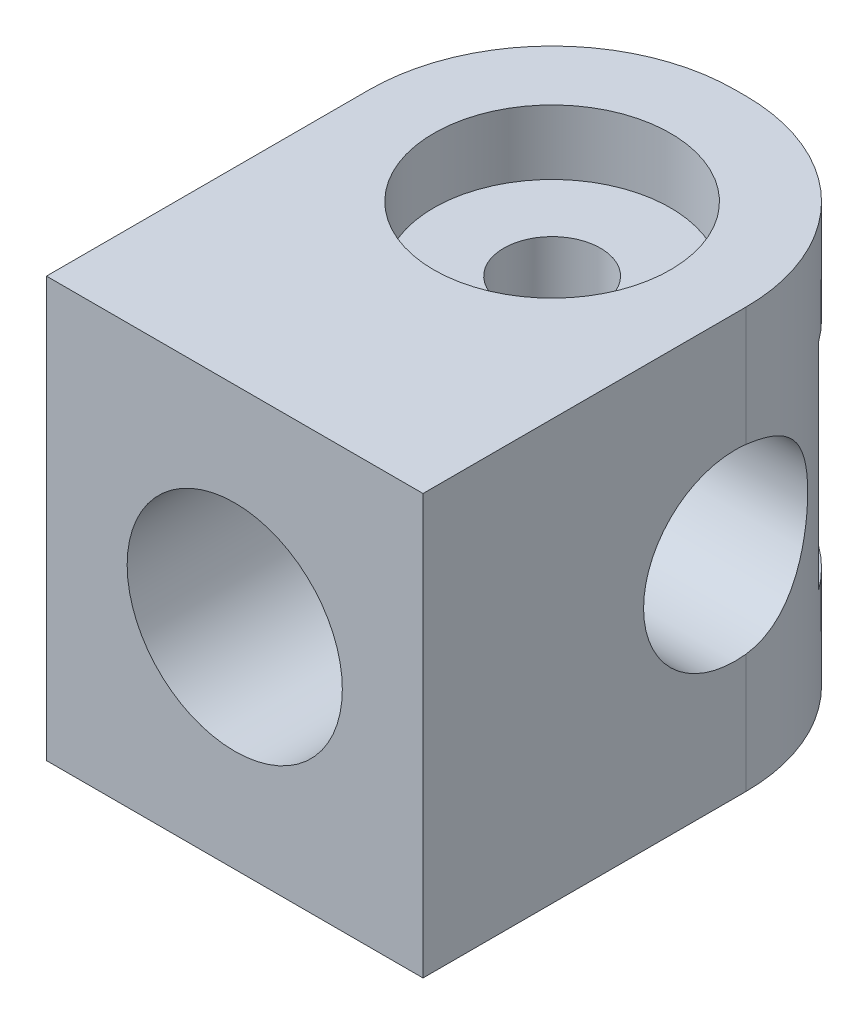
SolidWorks part; units mm, degrees
ref_plane "Plan de face" through (0, 0, 0) normal (0, 0, 1) x (1, 0, 0)
ref_plane "Plan de dessus" through (0, 0, 0) normal (0, 1, 0) x (1, 0, 0)
ref_plane "Plan de droite" through (0, 0, 0) normal (1, 0, 0) x (0, 0, -1)
sketch "Esquisse1" plane through (0, 0, 0) normal (0, 0, 1) x (1, 0, 0)
  line L1 (0, 0) -> (35, 0)
  line L2 (0, 0) -> (0, -39)
  line L3 (0, -39) -> (35, -39)
  line L4 (35, 0) -> (35, -39)
  dimension "D1" = 35
  dimension "D2" = 39
extrude "Boss.-Extru.1" add sketch "Esquisse1" along normal blind 47
sketch "Esquisse2" plane through (0, 0, 47) normal (0, 0, 1) x (1, 0, 0)
  line L0 (0, 0) -> (35, -39)
  circle A0 centre (17.5, -19.5) radius 10
extrude "Enlèv. mat.-Extru.1" cut sketch "Esquisse2" against normal blind 20 contours L0 A0 | L0 A0
fillet "Congé1" radius 17 2 edges at (0, -19.5, 0) (35, -19.5, 0)
sketch "Esquisse3" plane through (0, 0, 0) normal (0, 0, -1) x (-1, 0, 0)
  line L0 (-35, -39) -> (-35, -29.5)
  line L1 (0, 0) -> (0, -39) construction
  line L2 (-35, -29.5) -> (0, -29.5)
  line L3 (-35, -29.5) -> (-35, -9.5)
  line L4 (-35, -9.5) -> (0, -9.5)
  line L5 (0, -29.5) -> (0, -9.5)
  dimension "D1" = 9.5
  dimension "D2" = 20
extrude "Enlèv. mat.-Extru.2" cut sketch "Esquisse3" against normal blind 7 contours L4 L2 M7 M5 | L4 L3 L2 M7 | L2 L5 L4 M5
sketch "Esquisse4" plane through (35, 0, 0) normal (1, 0, 0) x (0, 0, -1)
  line L0 (-47, -39) -> (-18, -39)
  line L1 (-47, -39) -> (-17, -39) construction
  line L2 (-18, -39) -> (-18, 0)
  line L3 (-47, 0) -> (-17, 0) construction
  circle A0 centre (-18, -19.5) radius 8.5
  dimension "D2" = 17
  dimension "D1" = 29
extrude "Enlèv. mat.-Extru.3" cut sketch "Esquisse4" against normal blind 29 contours L2 A0 | A0 M3 | L2 A0 M3
sketch "Esquisse5" plane through (0, 0, 0) normal (0, 1, 0) x (1, 0, 0)
  line L0 (17.5, -47) -> (17.5, -17.5)
  line L1 (35, -47) -> (0, -47) construction
  circle A0 centre (17.5, -17.5) radius 4.5
  circle A1 centre (17.5, -17.5) radius 11
  dimension "D1" = 9
  dimension "D2" = 29.5
extrude "Enlèv. mat.-Extru.4" cut sketch "Esquisse5" against normal through all
sketch "Esquisse7" plane through (0, 0, 0) normal (0, 1, 0) x (1, 0, 0)
  circle A0 centre (17.5, -17.5) radius 11
extrude "Enlèv. mat.-Extru.5" cut sketch "Esquisse7" against normal blind 6
sketch "Esquisse8" plane through (0, -39, 0) normal (0, -1, 0) x (1, 0, 0)
  circle A0 centre (17.5, 17.5) radius 11
extrude "Enlèv. mat.-Extru.6" cut sketch "Esquisse8" against normal blind 6
sketch "Esquisse10" plane through (0, 0, 0) normal (-1, 0, 0) x (0, 0, 1)
  circle A0 centre (18, -19.5) radius 4.5
  circle A1 centre (18, -19.5) radius 8.5
  circle A2 centre (18, -19.5) radius 8.5
  dimension "D2" = 9
  dimension "D1" = 0
extrude "Enlèv. mat.-Extru.7" cut sketch "Esquisse10" against normal blind 6 contours A0 M3 | A0 M3
